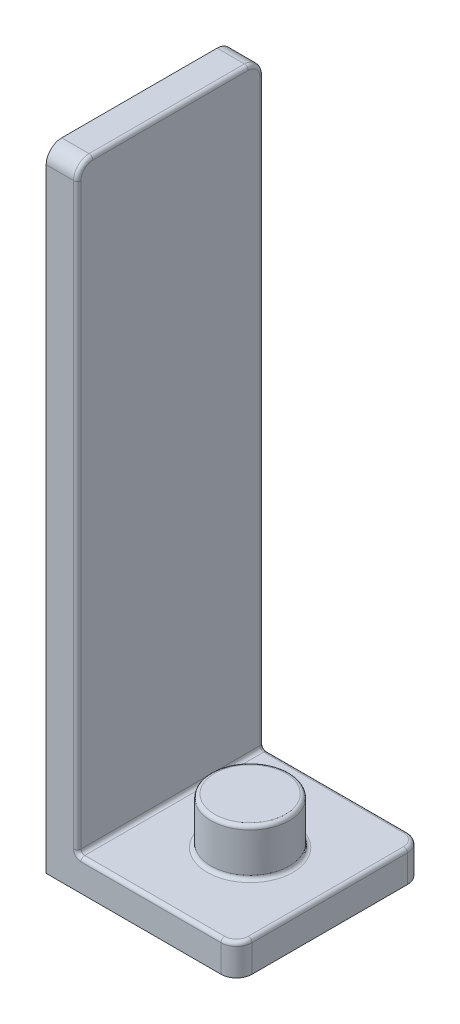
SolidWorks part; units mm, degrees
ref_plane "Front Plane" through (0, 0, 0) normal (0, 0, 1) x (1, 0, 0)
ref_plane "Top Plane" through (0, 0, 0) normal (0, 1, 0) x (1, 0, 0)
ref_plane "Right Plane" through (0, 0, 0) normal (1, 0, 0) x (0, 0, -1)
sketch "Sketch1"
  dimension "D1" = 244.475
  dimension "D2" = 65.0875
extrude "Extrude-Thin1" add sketch "Sketch1" along normal mid plane 76.2 thin
sketch "Sketch2"
extrude "Extrude1" add sketch "Sketch2" along normal blind 19.05
fillet "Fillet1" radius 6.35 4 edges at (65.0875, -6.35, -38.1) (65.0875, -6.35, 38.1) (-6.35, 244.475, -38.1) (-6.35, 244.475, 38.1)
fillet "Fillet2" radius 1.524 13 edges at (32.5438, 0, 16.0268) (0, 0, 0) (32.5438, 19.05, 16.0268) (0, 244.475, 0) (0, 242.6151, -36.2401) (0, 242.6151, 36.2401) (0, 119.0625, -38.1) (0, 119.0625, 38.1) (29.3687, 0, -38.1) (63.2276, 0, -36.2401) (65.0875, 0, 0) (63.2276, 0, 36.2401) (29.3687, 0, 38.1)
